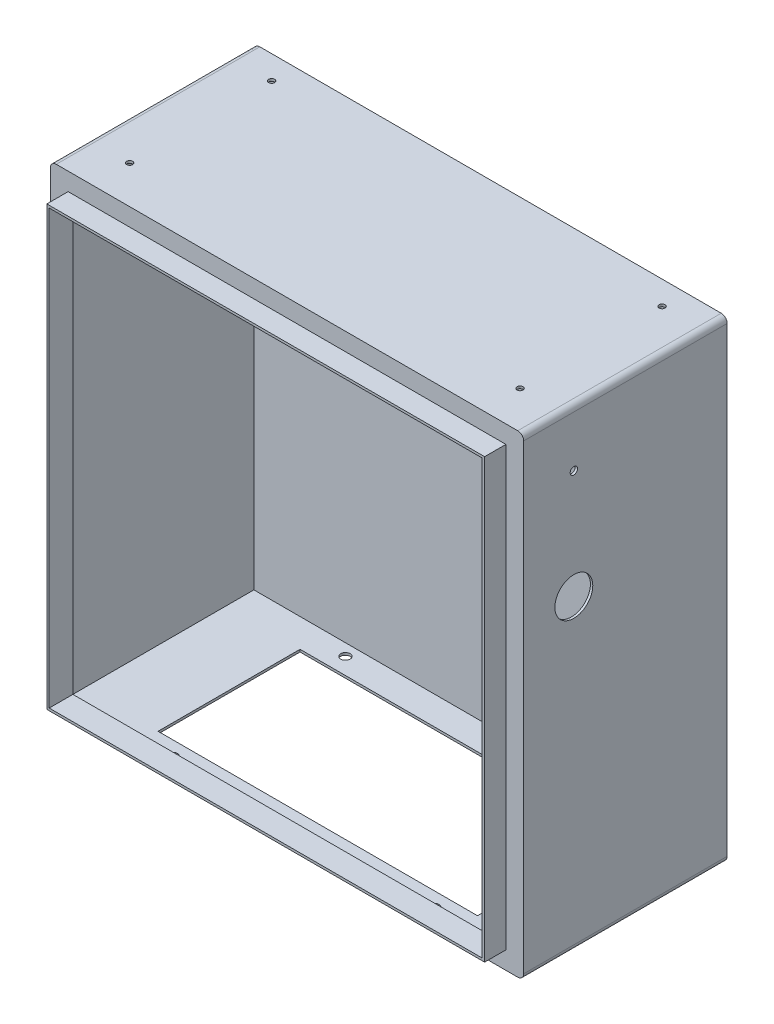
SolidWorks part; units mm, degrees
ref_plane "Plan de face" through (0, 0, 0) normal (0, 0, 1) x (1, 0, 0)
ref_plane "Plan de dessus" through (0, 0, 0) normal (0, 1, 0) x (1, 0, 0)
ref_plane "Plan de droite" through (0, 0, 0) normal (1, 0, 0) x (0, 0, -1)
sketch "Esquisse1" plane through (0, 0, 0) normal (0, 0, 1) x (1, 0, 0)
  line L1 (0, 0) -> (400, 0)
  line L2 (0, 0) -> (0, 400)
  line L3 (0, 400) -> (400, 400)
  line L4 (400, 0) -> (400, 400)
  dimension "D1" = 400
  dimension "D2" = 400
extrude "Boss.-Extru.1" add sketch "Esquisse1" along normal blind 170
ref_plane "Plan1" through (200, 0, 0) normal (1, 0, 0) x (0, 0, -1)
shell "Coque1" thickness 2
sketch "Esquisse2" plane through (0, 0, 170) normal (0, 0, 1) x (1, 0, 0)
  line L0 (400, 400) -> (0, 400) construction
  line L1 (400, 400) -> (0, 400)
  line L2 (0, 400) -> (0, 0) construction
  line L3 (0, 400) -> (0, 0)
  line L4 (400, 0) -> (400, 400) construction
  line L5 (400, 0) -> (400, 400)
  line L6 (0, 0) -> (400, 0) construction
  line L7 (0, 0) -> (400, 0)
  line L9 (15, 385) -> (385, 385)
  line L10 (15, 385) -> (15, 15)
  line L11 (15, 15) -> (385, 15)
  line L12 (385, 385) -> (385, 15)
  dimension "D1" = 15
  dimension "D2" = 15
  dimension "D3" = 15
  dimension "D4" = 15
extrude "Boss.-Extru.2" add sketch "Esquisse2" along normal blind 2
sketch "Esquisse3" plane through (0, 0, 172) normal (0, 0, 1) x (1, 0, 0)
  line L0 (15, 15) -> (385, 15) construction
  line L1 (385, 15) -> (385, 385) construction
  line L2 (15, 385) -> (15, 15) construction
  line L3 (385, 385) -> (15, 385) construction
  line L4 (15, 15) -> (385, 15)
  line L5 (385, 15) -> (385, 385)
  line L6 (15, 385) -> (15, 15)
  line L7 (385, 385) -> (15, 385)
  line L9 (17, 383) -> (383, 383)
  line L10 (17, 383) -> (17, 17)
  line L11 (17, 17) -> (383, 17)
  line L12 (383, 383) -> (383, 17)
  dimension "D1" = 2
  dimension "D2" = 2
  dimension "D3" = 2
  dimension "D4" = 2
extrude "Boss.-Extru.3" add sketch "Esquisse3" along normal blind 18 and the other way blind 2
fillet "Congé1" radius 5 4 edges at (400, 400, 86) (400, 0, 86) (0, 400, 86) (0, 0, 86)
sketch "Esquisse5" plane through (0, 0, 0) normal (0, -1, 0) x (1, 0, 0)
  line L0 (5, 0) -> (395, 0) construction
  line L1 (65, 146) -> (335, 146)
  line L2 (65, 146) -> (65, 26)
  line L3 (65, 26) -> (335, 26)
  line L4 (335, 146) -> (335, 26)
  line L5 (0, 0) -> (0, 172) construction
  dimension "D1" = 270
  dimension "D2" = 120
  dimension "D3" = 26
  dimension "D4" = 65
extrude "Enlèv. mat.-Extru.2" cut sketch "Esquisse5" against normal blind 5
sketch "Esquisse6" plane through (0, 400, 0) normal (0, 1, 0) x (1, 0, 0)
  circle A0 centre (35, -20) radius 2.5 construction
  circle A1 centre (35, -20) radius 2.5
  circle A2 centre (365, -140) radius 2.5 construction
  circle A3 centre (365, -140) radius 2.5
  circle A4 centre (365, -20) radius 2.5 construction
  circle A5 centre (365, -20) radius 2.5
  circle A6 centre (35, -140) radius 2.5 construction
  circle A7 centre (35, -140) radius 2.5
extrude "Enlèv. mat.-Extru.3" cut sketch "Esquisse6" against normal blind 10
sketch "Esquisse7" plane through (0, 0, 0) normal (0, -1, 0) x (1, 0, 0)
  line L0 (395, 12) -> (5, 12) construction
  line L1 (395, 0) -> (395, 172) construction
  line L2 (5, 172) -> (5, 0) construction
  line L3 (395, 158) -> (5, 158) construction
  line L4 (310.63, 6.2856) -> (310.63, 168.7702) construction
  line L5 (89.37, 6.2856) -> (89.37, 165) construction
  line L6 (5, 172) -> (395, 172) construction
  line L7 (335, 26) -> (335, 146) construction
  line L8 (65, 146) -> (65, 26) construction
  circle A0 centre (310.63, 12) radius 4
  circle A1 centre (89.37, 12) radius 4
  circle A2 centre (89.37, 158) radius 4
  circle A3 centre (310.63, 158) radius 4
  dimension "D1" = 8
  dimension "D6" = 8
  dimension "D7" = 8
  dimension "D8" = 8
  dimension "D2" = 146
  dimension "D3" = 14
  dimension "D4" = 24.37
  dimension "D5" = 24.37
extrude "Enlèv. mat.-Extru.4" cut sketch "Esquisse7" against normal blind 5
sketch "Esquisse8" plane through (400, 0, 0) normal (1, 0, 0) x (0, 0, -1)
  line L0 (-172, 5) -> (-172, 395) construction
  line L1 (-172, 400) -> (0, 400) construction
  circle A0 centre (-129.5893, 260) radius 16
  dimension "D1" = 32
  dimension "D2" = 42.4107
  dimension "D3" = 140
extrude "Enlèv. mat.-Extru.5" cut sketch "Esquisse8" against normal blind 10
sketch "Esquisse9" plane through (400, 0, 0) normal (1, 0, 0) x (0, 0, -1)
  line L0 (-129.5893, 260) -> (-129.5893, 400) construction
  circle A0 centre (-129.5893, 352) radius 3.1
  dimension "D1" = 6.2
  dimension "D2" = 92
extrude "Enlèv. mat.-Extru.6" cut sketch "Esquisse9" against normal blind 10
